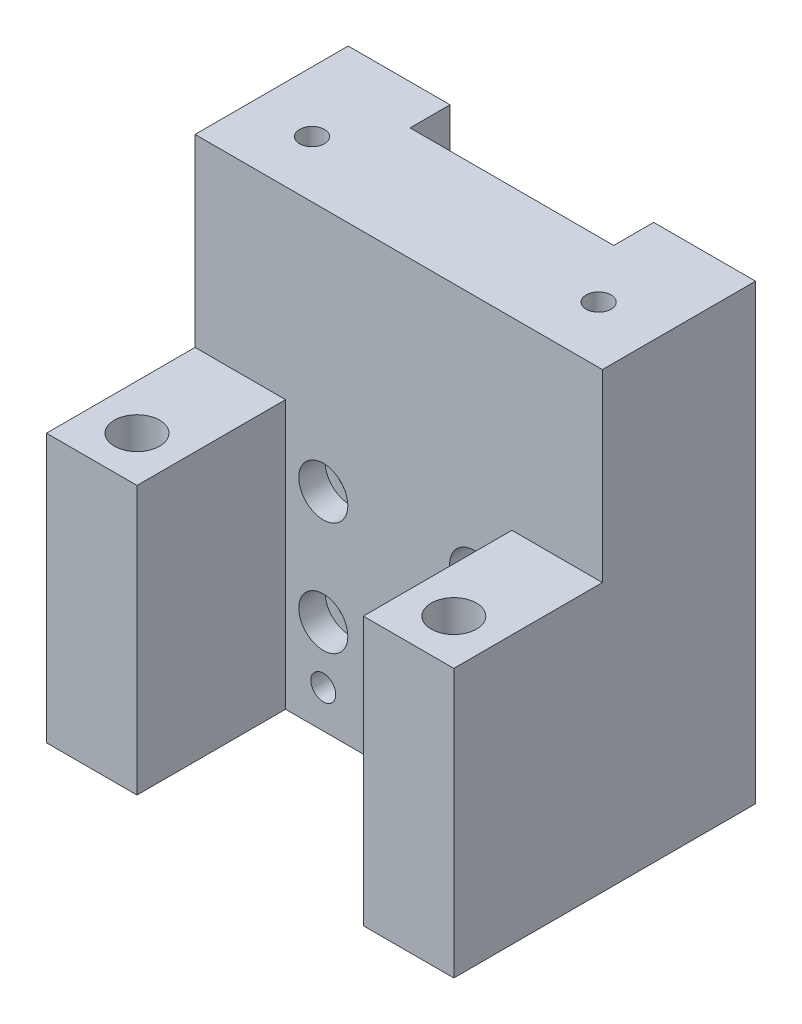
SolidWorks part; units mm, degrees
ref_plane "前视基准面" through (0, 0, 0) normal (0, 0, 1) x (1, 0, 0)
ref_plane "上视基准面" through (0, 0, 0) normal (0, 1, 0) x (1, 0, 0)
ref_plane "右视基准面" through (0, 0, 0) normal (1, 0, 0) x (0, 0, -1)
sketch "草图1" plane through (0, 0, 0) normal (0, 0, 1) x (1, 0, 0)
  line L0 (0, 0) -> (54, 0)
  line L1 (0, 0) -> (0, 60)
  line L2 (54, 0) -> (54, 60)
  line L3 (0, 60) -> (54, 60)
  circle A0 centre (17, 12.5) radius 1.75
  circle A1 centre (37, 12.5) radius 1.75
  circle A2 centre (37, 27.5) radius 1.75
  circle A3 centre (17, 27.5) radius 1.75
  circle A4 centre (17, 5) radius 1.65
  circle A5 centre (37, 5) radius 1.65
extrude "凸台-拉伸1" add sketch "草图1" along normal blind 40
sketch "草图2" plane through (54, 0, 0) normal (1, 0, 0) x (0, 0, -1)
  line L0 (-20.3, 35.549) -> (-20.3, 59.549)
  line L1 (-40, 35.549) -> (-20.3, 35.549)
  line L2 (-40, 35.549) -> (-40, 60)
  line L3 (-40, 60) -> (-20.3, 60)
  line L4 (-40, 60) -> (0, 60) construction
  line L5 (-20.3, 60) -> (-20.3, 59.549)
extrude "切除-拉伸4" cut sketch "草图2" against normal through all
sketch "草图3" plane through (0, 60, 0) normal (0, 1, 0) x (1, 0, 0)
  line L0 (0, -40) -> (12, -40)
  line L1 (12, -20.3) -> (42, -20.3)
  line L2 (13.5, -5.3) -> (40.5, -5.3)
  line L3 (0, -40) -> (0, 0)
  line L4 (54, -40) -> (54, 0)
  line L5 (12, -40) -> (12, -20.3)
  line L6 (42, -40) -> (42, -20.3)
  line L7 (42, -40) -> (54, -40)
  line L8 (13.5, -5.3) -> (13.5, 0)
  line L9 (40.5, -5.3) -> (40.5, 0)
  line L10 (0, 0) -> (13.5, 0)
  line L11 (40.5, 0) -> (54, 0)
extrude "切除-拉伸5" cut sketch "草图3" against normal through all flip side to cut
sketch "草图4" plane through (0, 0, 20.3) normal (0, 0, 1) x (1, 0, 0)
  circle A0 centre (17, 12.5) radius 3.25
  circle A1 centre (37, 12.5) radius 3.25
  circle A2 centre (37, 27.5) radius 3.25
  circle A3 centre (17, 27.5) radius 3.25
extrude "切除-拉伸6" cut sketch "草图4" against normal blind 3.5
sketch "草图5" plane through (0, 60, 0) normal (0, 1, 0) x (1, 0, 0)
  circle A0 centre (8, -12.8) radius 1.65
  circle A1 centre (46, -12.8) radius 1.65
extrude "切除-拉伸7" cut sketch "草图5" against normal blind 12
sketch "草图6" plane through (0, 35.549, 0) normal (0, 1, 0) x (1, 0, 0)
  circle A0 centre (6, -34) radius 3
  circle A1 centre (48, -34) radius 3
extrude "切除-拉伸8" cut sketch "草图6" against normal through all
